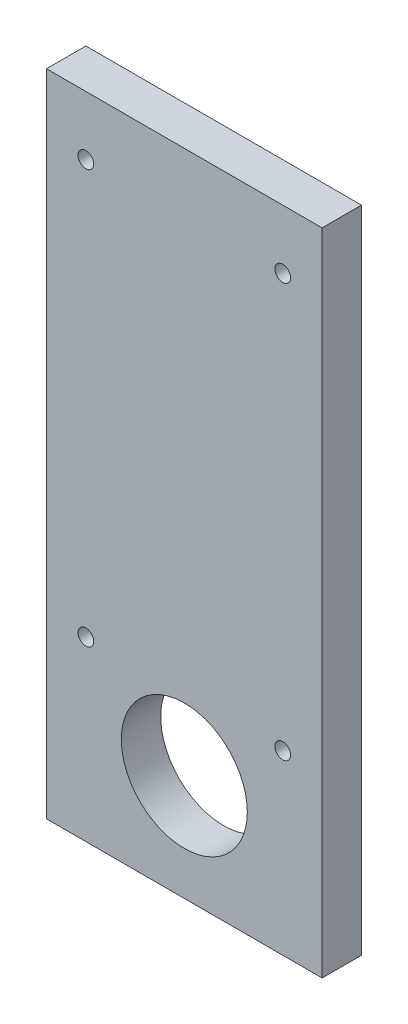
SolidWorks part; units mm, degrees
ref_plane "Alzado" through (0, 0, 0) normal (0, 0, 1) x (1, 0, 0)
ref_plane "Planta" through (0, 0, 0) normal (0, 1, 0) x (1, 0, 0)
ref_plane "Vista lateral" through (0, 0, 0) normal (1, 0, 0) x (0, 0, -1)
sketch "Croquis1" plane through (0, 0, 0) normal (0, 0, 1) x (1, 0, 0)
  line L1 (35, 138) -> (-35, 138)
  line L2 (-35, 138) -> (-35, -27)
  line L3 (-35, -27) -> (35, -27)
  line L4 (35, -27) -> (35, 138)
  circle A0 centre (0, 0) radius 16
  circle A2 centre (-25, 123) radius 2
  circle A3 centre (25, 123) radius 2
  circle A4 centre (25, 18) radius 2
  circle A5 centre (-25, 18) radius 2
extrude "Extruir1" add sketch "Croquis1" along normal blind 10
hole_wizard "Taladro roscado de M4-1" positions "Croquis3D4" profile "Croquis6" hole size "M4" standard "DIN"
sketch3d "Croquis3D4"
  point P1 (-25, -27, 5)
  point P3 (25, -27, 5)
sketch "Croquis6" plane through (-25, -27, 5) normal (1, 0, 0) x (0, 0, -1)
  line L0 (0, 0) -> (0, 15.9914)
  line L1 (0, 15.9914) -> (1.65, 15)
  line L2 (1.65, 15) -> (1.65, 0)
  line L5 (1.65, 0) -> (0, 0)
  line L10 (0, 15.9914) -> (-1.65, 15) construction
  line L11 (0, -6.35) -> (0, 107.95) construction
  dimension "Diámetro de taladro" = 3.3
  dimension "Profundidad de taladro" = 15
  dimension "Ángulo de perforador" = 118
